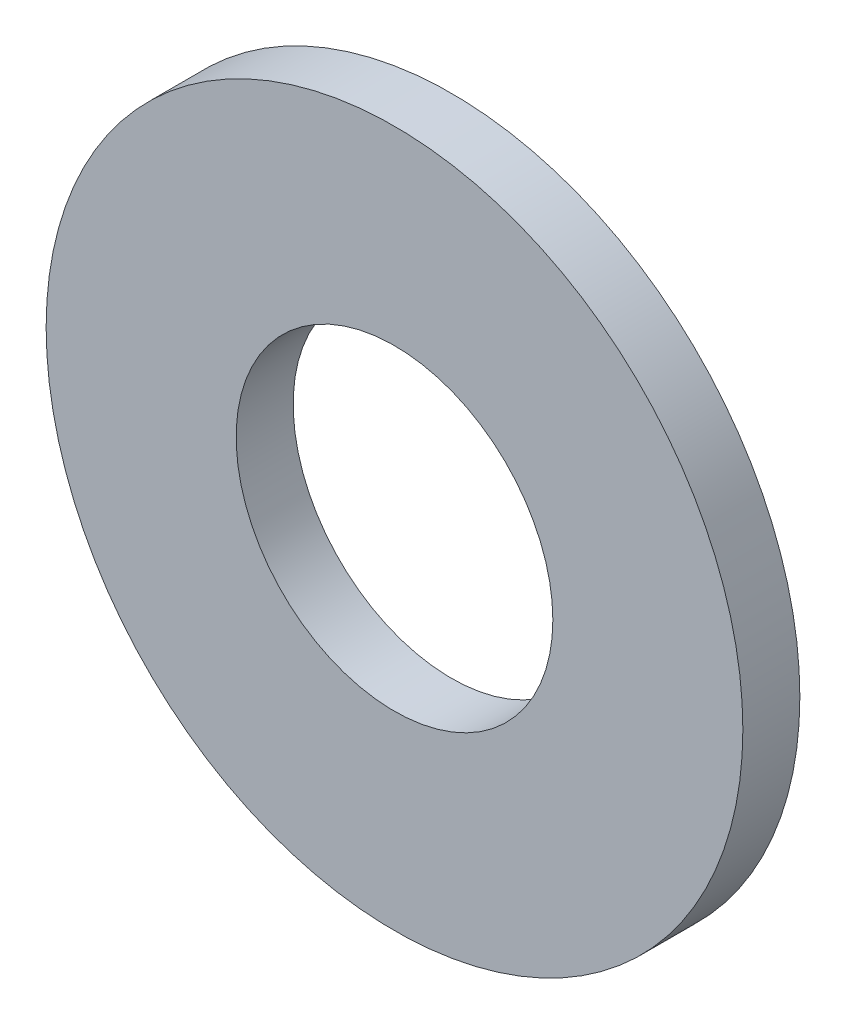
SolidWorks part; units mm, degrees
ref_plane "Plan de face" through (0, 0, 0) normal (0, 0, 1) x (1, 0, 0)
ref_plane "Plan de dessus" through (0, 0, 0) normal (0, 1, 0) x (1, 0, 0)
ref_plane "Plan de droite" through (0, 0, 0) normal (1, 0, 0) x (0, 0, -1)
sketch "Esquisse1" plane through (0, 0, 0) normal (0, 0, 1) x (1, 0, 0)
  circle A0 centre (0, 0) radius 5
  circle A1 centre (0, 0) radius 11
  dimension "D1" = 10
  dimension "D2" = 22
extrude "Boss.-Extru.1" add sketch "Esquisse1" along normal blind 1.8
